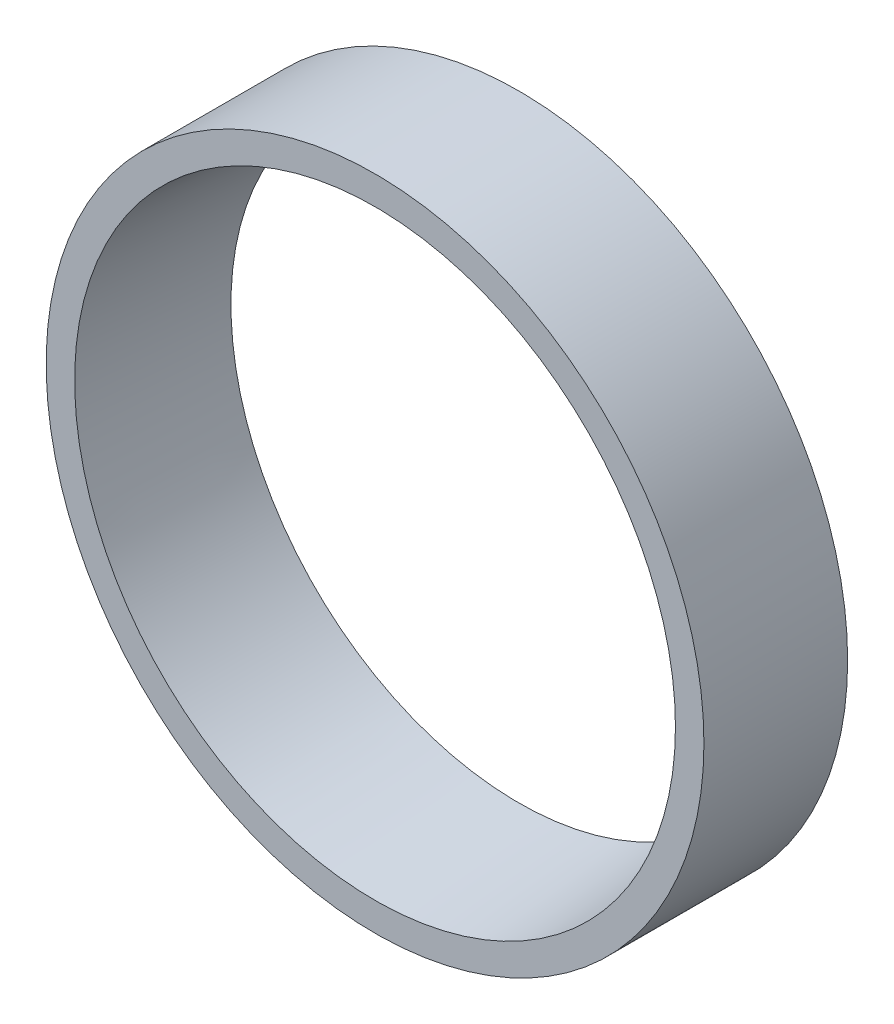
SolidWorks part; units mm, degrees
ref_plane "Plan de face" through (0, 0, 0) normal (0, 0, 1) x (1, 0, 0)
ref_plane "Plan de dessus" through (0, 0, 0) normal (0, 1, 0) x (1, 0, 0)
ref_plane "Plan de droite" through (0, 0, 0) normal (1, 0, 0) x (0, 0, -1)
sketch "Esquisse1" plane through (0, 0, -154.8113) normal (0, 0, 1) x (1, 0, 0)
  circle A1 centre (0, 0) radius 70.1
  circle A2 centre (0, 0) radius 80.1
  dimension "D1" = 10
  dimension "D2" = 140.2
extrude "Boss.-Extru.1" add sketch "Esquisse1" against normal up to surface (35 mm away)
draft "Dépouille1" type of draft neutral plane draft angle 5 faces to draft 1 parameters "D1"=5
